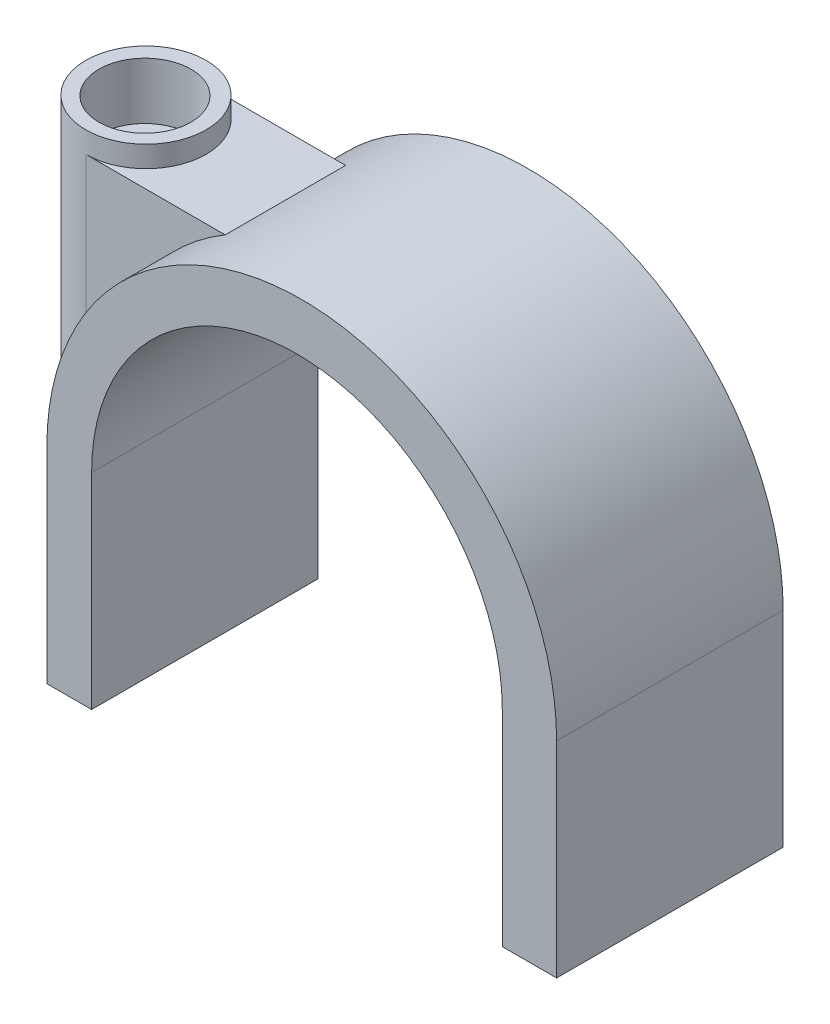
SolidWorks part; units mm, degrees
ref_plane "Face" through (0, 0, 0) normal (0, 0, 1) x (1, 0, 0)
ref_plane "Dessus" through (0, 0, 0) normal (0, 1, 0) x (1, 0, 0)
ref_plane "Droite" through (0, 0, 0) normal (1, 0, 0) x (0, 0, -1)
sketch "Esquisse1" plane through (0, 0, 0) normal (0, 0, 1) x (1, 0, 0)
  line L0 (0, 0) -> (3.5, 0)
  line L1 (36, 0) -> (36, 14.5)
  line L2 (32.5, 0) -> (36, 0)
  line L3 (0, 0) -> (0, 14.5)
  line L5 (32.5, 0) -> (3.5, 0)
  arc A0 (36, 14.5) -> (0, 14.5) centre (18, 14.5) ccw
extrude "Base-Extrusion" add sketch "Esquisse1" along normal blind 16
sketch "Esquisse2" plane through (0, 0, 0) normal (0, -1, 0) x (1, 0, 0)
  line L0 (0, 16) -> (0, 0) construction
  circle A0 centre (-1, 8) radius 4.25
  dimension "D1" = 8
  dimension "D2" = 1
extrude "Boss.-Extru.1" add sketch "Esquisse2" against normal blind 31.5
ref_plane "Plan1" through (-1, 0, 0) normal (-1, 0, 0) x (0, 0, 1)
sketch "Esquisse3" plane through (-1, 0, 0) normal (-1, 0, 0) x (0, 0, 1)
  line L0 (3.75, 0) -> (3.75, 30)
  line L1 (3.75, 30) -> (12.25, 30)
  line L2 (12.25, 30) -> (12.25, 0)
  line L3 (12.25, 0) -> (3.75, 0)
  dimension "D1" = 3.75
extrude "Boss.-Extru.2" add sketch "Esquisse3" against normal up to surface (8.3346 mm away)
sketch "Esquisse4" plane through (0, 0, 0) normal (0, 0, 1) x (1, 0, 0)
  line L1 (32.1626, 14.5) -> (32.1626, 0)
  line L2 (0, 0) -> (36, 0) construction
  line L3 (32.1626, 0) -> (3.1626, 0)
  line L4 (3.1626, 0) -> (3.1626, 14.5)
  arc A0 (32.1626, 14.5) -> (3.1626, 14.5) centre (17.6626, 14.5) ccw
  dimension "D1" = 14.5
  dimension "D2" = 14.5
extrude "Enlèv. mat.-Extru.2" cut sketch "Esquisse4" along normal through all
sketch "Esquisse5" plane through (0, 31.5, 0) normal (0, 1, 0) x (-1, 0, 0)
  line L0 (1, -3.8693) -> (1, 3.8693) construction
  circle A0 centre (1, 8.0731) radius 3.25
extrude "Enlèv. mat.-Extru.3" cut sketch "Esquisse5" against normal blind 4
sketch "Esquisse6" plane through (0, 27.5, 0) normal (0, 1, 0) x (-1, 0, 0)
  circle A0 centre (1, 8) radius 1.25
extrude "Enlèv. mat.-Extru.4" cut sketch "Esquisse6" against normal through all
